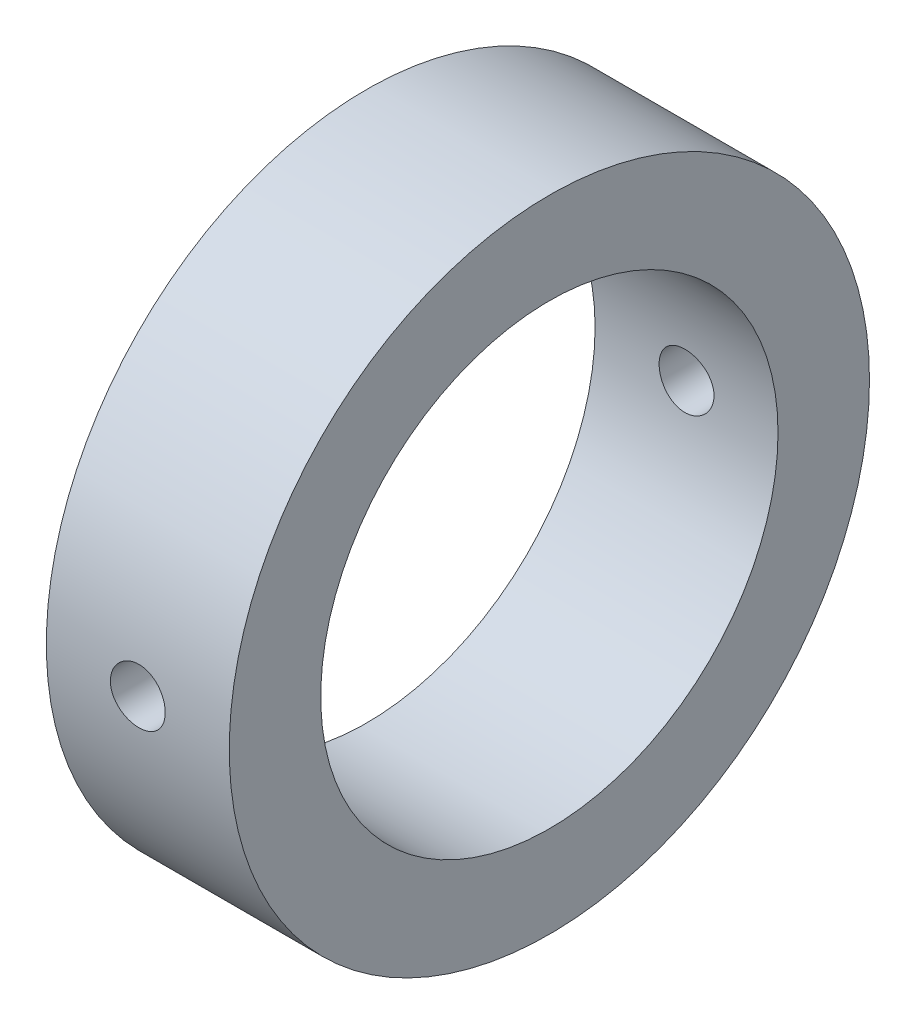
SolidWorks part; units mm, degrees
ref_plane "Front Plane" through (0, 0, 0) normal (1, 0, 0) x (0, 1, 0)
ref_plane "Top Plane" through (0, 0, 0) normal (0, 0, 1) x (0, 1, 0)
ref_plane "Right Plane" through (0, 0, 0) normal (0, 1, 0) x (-1, 0, 0)
sketch "Sketch1" plane through (0, 0, 0) normal (1, 0, 0) x (0, 1, 0)
  circle A0 centre (0, 0) radius 35
  circle A1 centre (0, 0) radius 25
  dimension "D1" = 70
  dimension "D2" = 50
extrude "Boss-Extrude1" add sketch "Sketch1" along normal blind 20
sketch "Sketch2" plane through (0, 0, 0) normal (0, 0, 1) x (0, 1, 0)
  line L0 (35, 0) -> (-35, 0) construction
  circle A0 centre (0, -10) radius 3
  point P4 (0, 0)
  dimension "D1" = 6
  dimension "D2" = 10
extrude "Cut-Extrude1" cut sketch "Sketch2" against normal through all both and the other way through all
